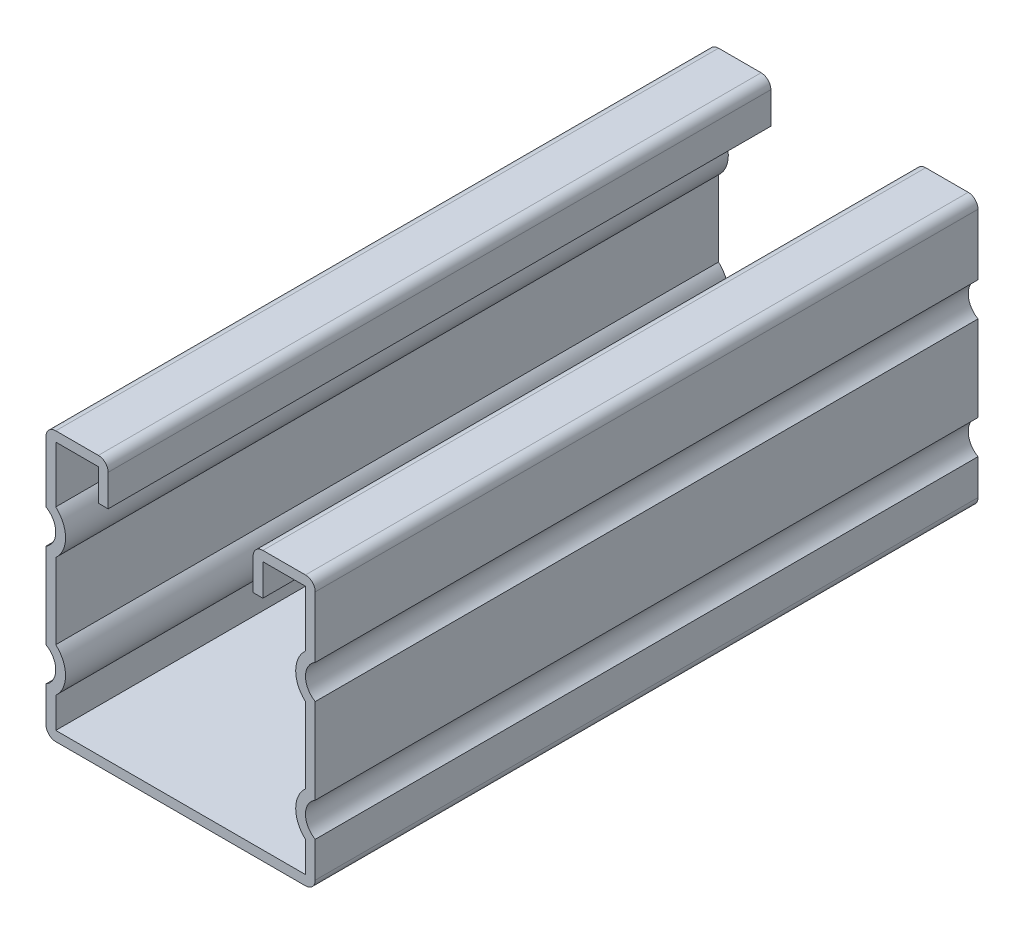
SolidWorks part; units mm, degrees
ref_plane "Plane1" through (0, 0, 0) normal (0, 0, 1) x (1, 0, 0)
ref_plane "Plane2" through (0, 0, 0) normal (0, 1, 0) x (1, 0, 0)
ref_plane "Plane3" through (0, 0, 0) normal (1, 0, 0) x (0, 0, -1)
sketch "Sketch1" plane through (0, 0, 0) normal (0, 0, 1) x (1, 0, 0)
  line L0 (-20.6375, 21.1074) -> (-20.6375, 11.7397)
  line L1 (-20.6375, 6.5483) -> (-20.6375, -6.5483)
  line L2 (-19.1389, -18.669) -> (19.1389, -18.669)
  line L3 (20.6375, -17.1704) -> (20.6375, -11.7397)
  line L4 (20.6375, 11.7397) -> (20.6375, 21.1074)
  line L5 (19.1389, 22.606) -> (12.6111, 22.606)
  line L6 (11.1125, 21.1074) -> (11.1125, 16.256)
  line L7 (-19.1389, 22.606) -> (-12.6111, 22.606)
  line L8 (-11.1125, 21.1074) -> (-11.1125, 16.256)
  line L9 (19.1389, -12.495) -> (19.1389, 12.495) construction
  line L10 (-19.1389, 12.495) -> (-19.1389, -12.495) construction
  line L11 (-12.6111, 21.1074) -> (-12.6111, 16.256)
  line L12 (-19.1389, 21.1074) -> (-12.6111, 21.1074)
  line L13 (-19.1389, 21.1074) -> (-19.1389, 12.495)
  line L14 (-19.1389, 5.793) -> (-19.1389, -5.793)
  line L15 (-19.1389, -17.1704) -> (19.1389, -17.1704)
  line L16 (19.1389, -17.1704) -> (19.1389, -12.495)
  line L17 (19.1389, 12.495) -> (19.1389, 21.1074)
  line L18 (19.1389, 21.1074) -> (12.6111, 21.1074)
  line L19 (12.6111, 21.1074) -> (12.6111, 16.256)
  line L20 (-12.6111, 16.256) -> (-11.1125, 16.256)
  line L21 (11.1125, 16.256) -> (12.6111, 16.256)
  line L22 (-10.16, 0) -> (12.7, 0) construction
  line L23 (-20.6375, -11.7397) -> (-20.6375, -17.1704)
  line L24 (-19.1389, -12.495) -> (-19.1389, -17.1704)
  line L25 (20.6375, -6.5483) -> (20.6375, 6.5483)
  line L26 (19.1389, -5.793) -> (19.1389, 5.793)
  arc A0 (20.6375, 11.7397) -> (20.6375, 6.5483) centre (22.1361, 9.144) ccw
  arc A1 (-20.6375, 6.5483) -> (-20.6375, 11.7397) centre (-22.1361, 9.144) ccw
  arc A2 (-12.6111, 22.606) -> (-11.1125, 21.1074) centre (-12.6111, 21.1074) cw
  arc A3 (-20.6375, 21.1074) -> (-19.1389, 22.606) centre (-19.1389, 21.1074) cw
  arc A4 (-19.1389, -18.669) -> (-20.6375, -17.1704) centre (-19.1389, -17.1704) cw
  arc A5 (20.6375, -17.1704) -> (19.1389, -18.669) centre (19.1389, -17.1704) cw
  arc A6 (19.1389, 22.606) -> (20.6375, 21.1074) centre (19.1389, 21.1074) cw
  arc A7 (11.1125, 21.1074) -> (12.6111, 22.606) centre (12.6111, 21.1074) cw
  arc A8 (-19.1389, 5.793) -> (-19.1389, 12.495) centre (-22.1361, 9.144) ccw
  arc A9 (19.1389, 12.495) -> (19.1389, 5.793) centre (22.1361, 9.144) ccw
  arc A10 (20.6375, -11.7397) -> (20.6375, -6.5483) centre (22.1361, -9.144) cw
  arc A11 (19.1389, -12.495) -> (19.1389, -5.793) centre (22.1361, -9.144) cw
  arc A12 (-19.1389, -5.793) -> (-19.1389, -12.495) centre (-22.1361, -9.144) cw
  arc A13 (-20.6375, -6.5483) -> (-20.6375, -11.7397) centre (-22.1361, -9.144) cw
  dimension "D1" = 20.6375
  dimension "D9" = 2.9972
  dimension "D10" = 2.9972
  dimension "D2" = 9.525
  dimension "Width" = 41.275
  dimension "base" = 18.669
  dimension "ToeHt" = 22.606
  dimension "D6" = 22.225
  dimension "edge" = 9.525
  dimension "Lip" = 6.35
  dimension "gauge" = 1.4986
extrude "Base-Extrude" add sketch "Sketch1" along normal blind 101.6
other "Hole1"
sketch "Sketch3" plane through (0, -18.669, 0) normal (0, -1, 0) x (1, 0, 0)
  circle A0 centre (0, 23.8125) radius 7.1438
  dimension "D1" = 14.2875
  dimension "D2" = 23.8125
pattern_linear "LPattern2" count 2 spacing 47.625 along (0, 0, 1) of "Hole1"
equation "\"D1@Sketch1\" = \"Width@Sketch1\" / 2"
equation "\"D6@Sketch1\" = \"Width@Sketch1\" - 2 * \"edge@Sketch1\""
equation "\"D10@Sketch1\" = 2 * \"gauge@Sketch1\""
equation "\"D9@Sketch1\" = \"D10@Sketch1\""
equation "\"D2@Sketch1\" = \"edge@Sketch1\""
equation "\"D1@LPattern2\" = \"D1@Base-Extrude\" / \"D3@LPattern2\""
